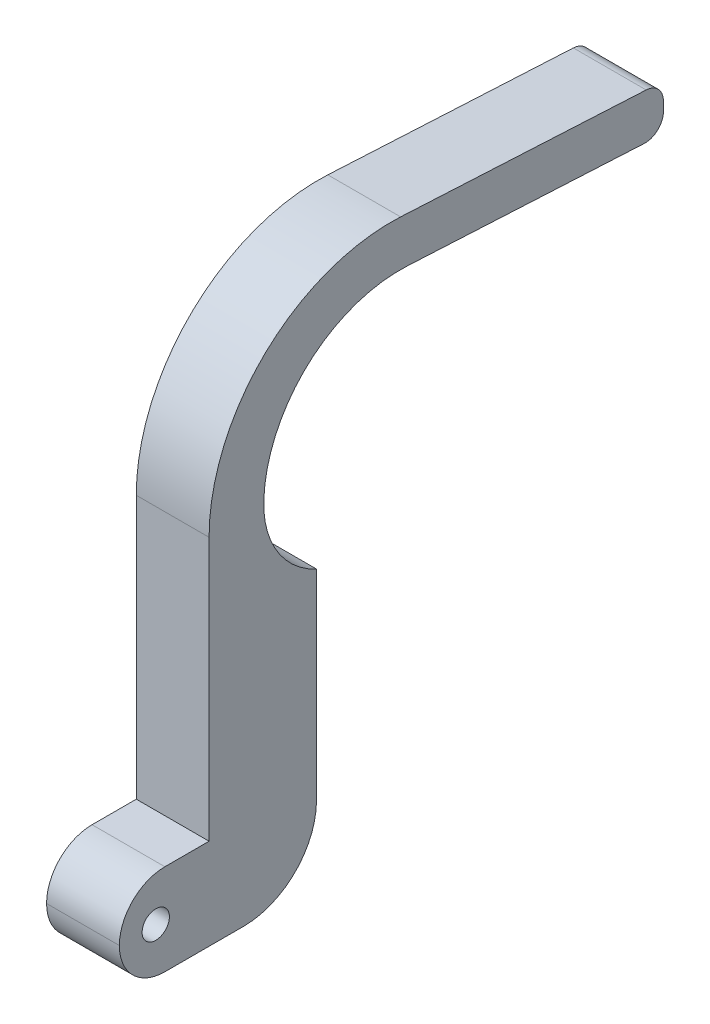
SolidWorks part; units mm, degrees
ref_plane "Спереди" through (0, 0, 0) normal (0, 0, 1) x (1, 0, 0)
ref_plane "Сверху" through (0, 0, 0) normal (0, 1, 0) x (1, 0, 0)
ref_plane "Справа" through (0, 0, 0) normal (1, 0, 0) x (0, 0, -1)
sketch "Sketch2" plane through (0, 0, 0) normal (1, 0, 0) x (0, 0, -1)
  line L0 (0, 0) -> (9.8583, 0)
  line L1 (9.8583, 0) -> (9.8583, 50)
  line L2 (9.8583, 50) -> (59.7898, 47.3832)
  line L3 (59.7898, 47.3832) -> (59.7898, 42.3832)
  line L4 (59.7898, 42.3832) -> (15.8583, 44.6856)
  line L5 (0, -10) -> (21.666, -10)
  line L6 (0, 0) -> (0, -10)
  line L7 (21.666, 20) -> (15.8583, 20)
  line L8 (15.8583, 20) -> (15.8583, 44.6856)
  line L9 (21.666, -10) -> (21.666, 20)
  dimension "D1" = 5
  dimension "D2" = 87
  dimension "D3" = 10
  dimension "D4" = 30
  dimension "D5" = 60
  dimension "D6" = 50
  dimension "D7" = 6
extrude "Boss-Extrude2" add sketch "Sketch2" along normal blind 8
fillet "Fillet1" radius 15 1 edges at (4, 44.6856, -15.8583)
fillet "Fillet2" radius 20 1 edges at (4, 50, -9.8583)
fillet "Fillet3" radius 10 1 edges at (4, 20, -15.8583)
fillet "Fillet4" radius 2 2 edges at (4, 47.3832, -59.7898) (4, 42.3832, -59.7898)
fillet "Fillet5" radius 5 2 edges at (4, -10, 0) (4, 0, 0)
sketch "Sketch3" plane through (8, 0, 0) normal (1, 0, 0) x (0, 0, -1)
  line L0 (0, -5) -> (21.666, -5) construction
  line L1 (21.666, -10) -> (21.666, 20) construction
  circle A0 centre (4, -5) radius 1.5
  dimension "D1" = 3
  dimension "D2" = 4
extrude "Cut-Extrude1" cut sketch "Sketch3" against normal through all
fillet "Fillet6" radius 8 1 edges at (4, -10, -21.666)
